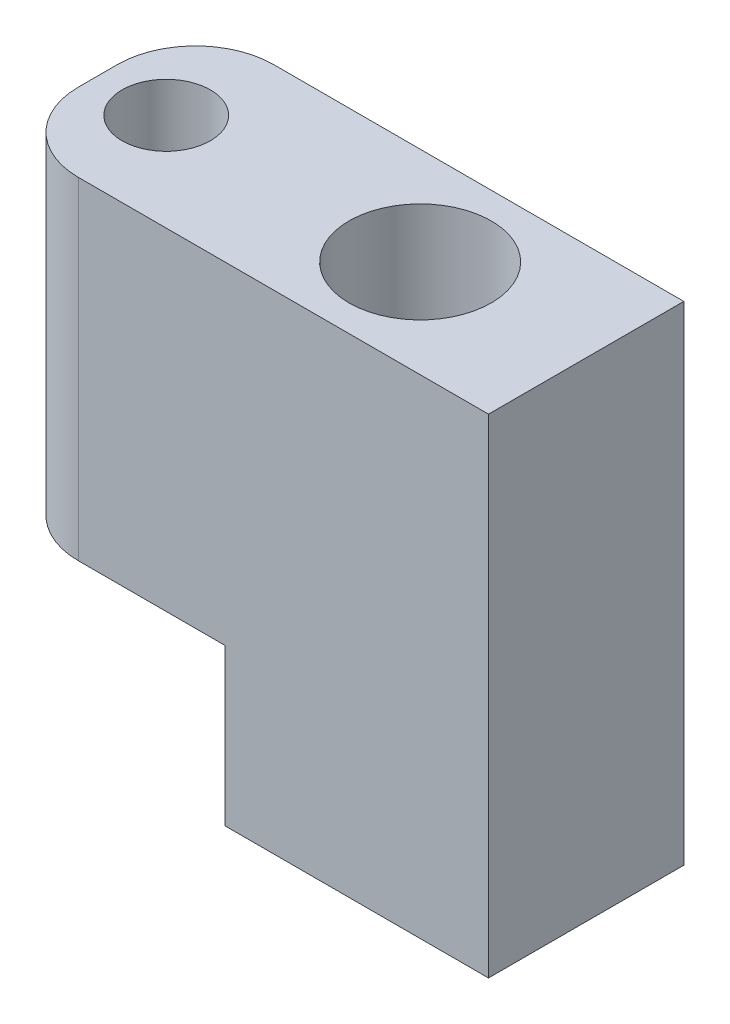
SolidWorks part; units mm, degrees
ref_plane "Front" through (0, 0, 0) normal (0, 0, 1) x (1, 0, 0)
ref_plane "Top" through (0, 0, 0) normal (0, 1, 0) x (1, 0, 0)
ref_plane "Right" through (0, 0, 0) normal (1, 0, 0) x (0, 0, -1)
sketch "Sketch2" plane through (0, 0, 0) normal (0, 1, 0) x (1, 0, 0)
  line L1 (17.4625, 3.175) -> (30.7975, 3.175)
  line L2 (14.9225, 0.635) -> (14.9225, -0.635)
  line L3 (17.4625, -3.175) -> (30.7975, -3.175)
  line L4 (30.7975, 3.175) -> (30.7975, -3.175)
  circle A0 centre (0, 0) radius 14.2875 construction
  circle A1 centre (0, 0) radius 25.4 construction
  circle A2 centre (18.0975, 0) radius 1.7526 construction
  circle A3 centre (25.4, 0) radius 1.7526 construction
  circle A4 centre (0, 0) radius 18.0975 construction
  arc A5 (14.9225, -0.635) -> (17.4625, -3.175) centre (17.4625, -0.635) ccw
  arc A6 (17.4625, 3.175) -> (14.9225, 0.635) centre (17.4625, 0.635) ccw
  dimension "D1" = 6.35
  dimension "D3" = 28.575
  dimension "D4" = 50.8
  dimension "D6" = 3.5052
  dimension "D7" = 3.5052
  dimension "D10" = 2.54
  dimension "D2" = 3.175
  dimension "D5" = 3.175
  dimension "D8" = 14.9225
  dimension "D9" = 15.875
extrude "Boss-Extrude1" add sketch "Sketch2" along normal blind 15.875
sketch "Sketch3" plane through (0, 0, 3.175) normal (0, 0, 1) x (1, 0, 0)
  line L1 (0, 0) -> (22.225, 0)
  line L2 (0, 0) -> (0, 5.08)
  line L3 (0, 5.08) -> (22.225, 5.08)
  line L4 (22.225, 0) -> (22.225, 5.08)
  dimension "D1" = 5.08
  dimension "D2" = 22.225
extrude "Cut-Extrude1" cut sketch "Sketch3" against normal through all contours L3 L4 L1 L2
hole_wizard "#14 (0.182) Diameter Hole1" positions "Sketch4" profile "Sketch5" hole size "#14" standard "ANSI Inch"
sketch "Sketch4" plane through (0, 15.875, 0) normal (0, 1, 0) x (1, 0, 0)
  line L0 (30.7975, 3.175) -> (17.4625, 3.175) construction
  point P0 (25.4, 0)
  dimension "D1" = 25.4
  dimension "D2" = 3.175
sketch "Sketch5" plane through (25.4, 15.875, 0) normal (1, 0, 0) x (0, 0, 1)
  line L0 (0, 0) -> (0, 15.875)
  line L1 (0, 15.875) -> (2.3114, 15.875)
  line L2 (2.3114, 15.875) -> (2.3114, 0)
  line L5 (2.3114, 0) -> (0, 0)
  line L11 (0, -6.35) -> (0, 107.95) construction
  dimension "Thru Hole Dia." = 4.6228
  dimension "Thru Hole Depth" = 15.875
hole_wizard "#6-40 Tapped Hole1" positions "Sketch7" profile "Sketch8" tap size "#6-40" standard "ANSI Inch"
sketch "Sketch7" plane through (0, 15.875, 0) normal (0, 1, 0) x (1, 0, 0)
  point P0 (17.145, 0)
  dimension "D1" = 17.145
sketch "Sketch8" plane through (17.145, 15.875, 0) normal (1, 0, 0) x (0, 0, 1)
  line L0 (0, 0) -> (0, 15.875)
  line L1 (0, 15.875) -> (1.4351, 15.875)
  line L2 (1.4351, 15.875) -> (1.4351, 0)
  line L5 (1.4351, 0) -> (0, 0)
  line L11 (0, -6.35) -> (0, 107.95) construction
  dimension "Thru Tap Drill Dia." = 2.8702
  dimension "Thru Tap Drill Depth" = 15.875
